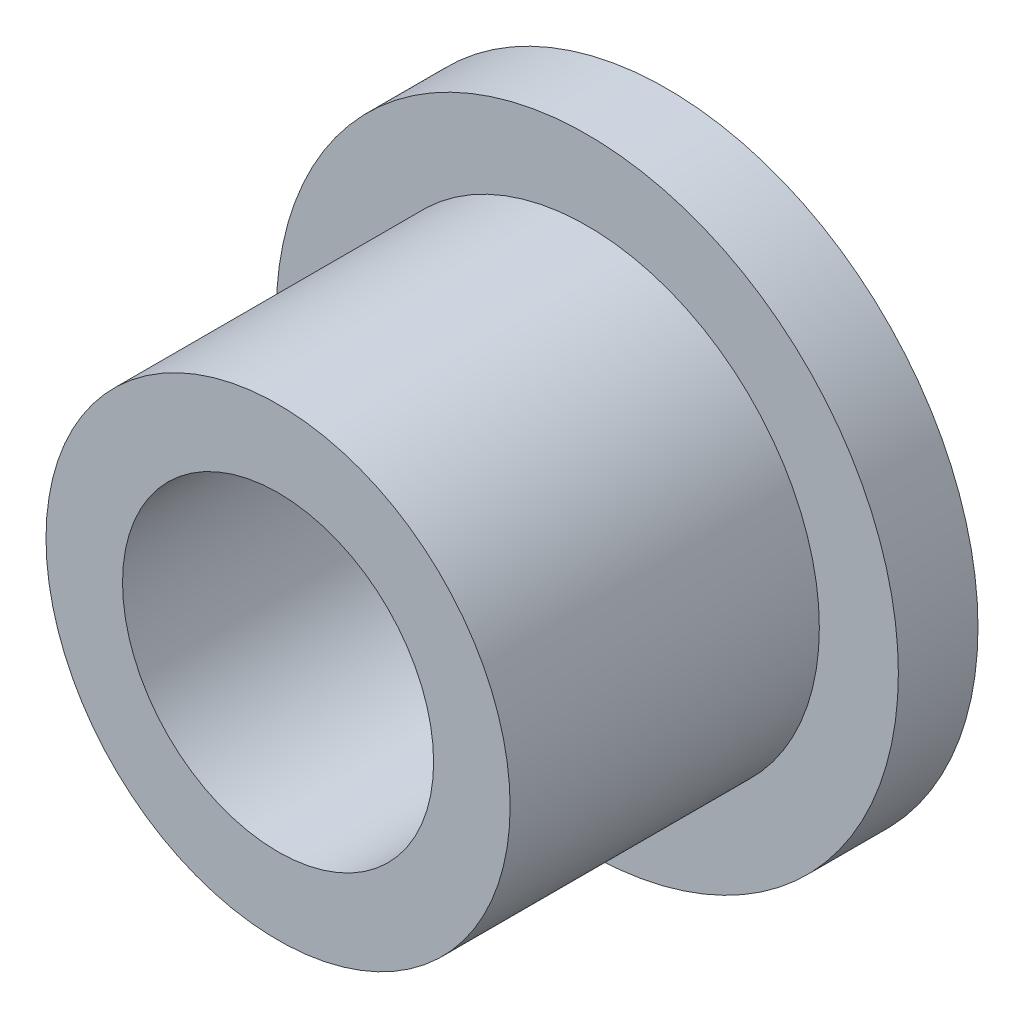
SolidWorks part; units mm, degrees
ref_plane "Front Plane" through (0, 0, 0) normal (0, 0, 1) x (1, 0, 0)
ref_plane "Top Plane" through (0, 0, 0) normal (0, 1, 0) x (1, 0, 0)
ref_plane "Right Plane" through (0, 0, 0) normal (1, 0, 0) x (0, 0, -1)
sketch "Sketch1" plane through (0, 0, 0) normal (0, 0, 1) x (1, 0, 0)
  circle A0 centre (0, 0) radius 4.7371
extrude "Boss-Extrude1" add sketch "Sketch1" along normal blind 7.9375
sketch "Sketch2" plane through (0, 0, 0) normal (0, 0, -1) x (-1, 0, 0)
  circle A0 centre (0, 0) radius 3.175
extrude "Cut-Extrude1" cut sketch "Sketch2" against normal through all
sketch "Sketch3" plane through (0, 0, 0) normal (0, 0, -1) x (-1, 0, 0)
  circle A0 centre (0, 0) radius 4.7371
  circle A1 centre (0, 0) radius 6.35
extrude "Boss-Extrude2" add sketch "Sketch3" against normal blind 1.6256
equation "\"OD\"= .373in"
equation "\"ID\"= .25in"
equation "\"Length\"= .3125"
equation "\"Lip_D\"= .5in"
equation "\"Lip_thick\"= .064"
equation "\"D1@Sketch1\"=\"OD\""
equation "\"D1@Boss-Extrude1\"=\"Length\""
equation "\"D1@Sketch2\"=\"ID\""
equation "\"D1@Sketch3\"=\"Lip_D\""
equation "\"D2@Sketch3\"=\"OD\""
equation "\"D1@Boss-Extrude2\"=\"Lip_thick\""
